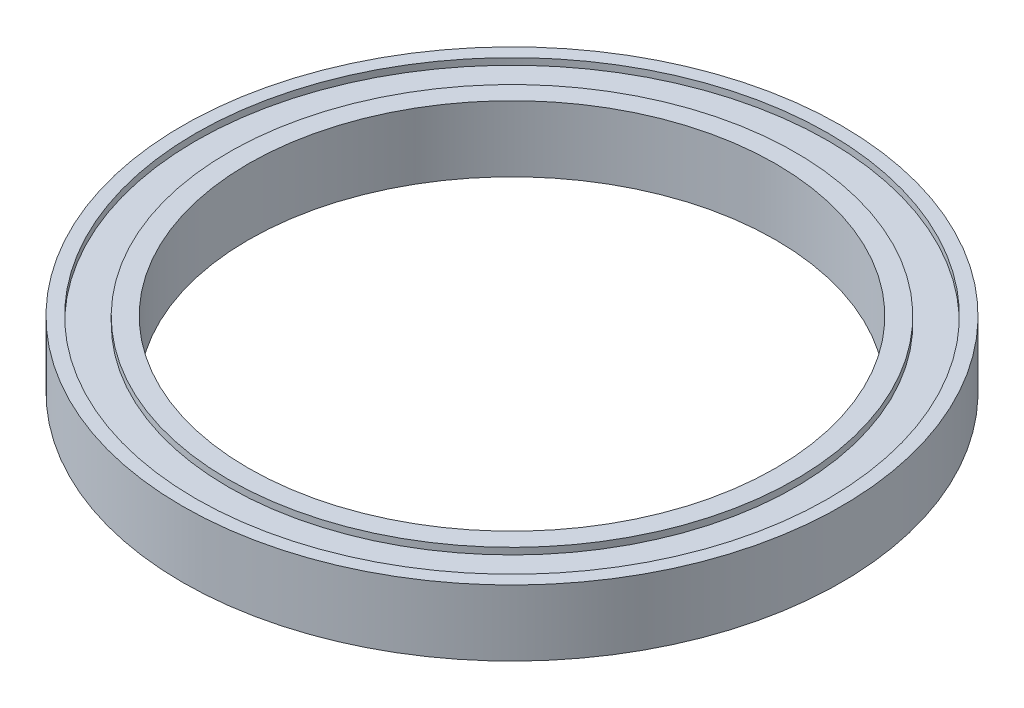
SolidWorks part; units mm, degrees
ref_plane "Front Plane" through (0, 0, 0) normal (0, 0, 1) x (1, 0, 0)
ref_plane "Top Plane" through (0, 0, 0) normal (0, 1, 0) x (1, 0, 0)
ref_plane "Right Plane" through (0, 0, 0) normal (1, 0, 0) x (0, 0, -1)
sketch "Sketch1" plane through (0, 0, 0) normal (0, 1, 0) x (1, 0, 0)
  circle A0 centre (0, 0) radius 40
  circle A1 centre (0, 0) radius 50
  dimension "D1" = 100
  dimension "D2" = 80
extrude "Boss-Extrude1" add sketch "Sketch1" along normal blind 10
sketch "Sketch2" plane through (0, 10, 0) normal (0, 1, 0) x (1, 0, 0)
  circle A0 centre (0, 0) radius 43
  circle A1 centre (0, 0) radius 48
  circle A2 centre (0, 0) radius 50 construction
  circle A3 centre (0, 0) radius 40 construction
  dimension "D1" = 2
  dimension "D2" = 3
extrude "Cut-Extrude1" cut sketch "Sketch2" against normal blind 1
sketch "Sketch3" plane through (0, 0, 0) normal (0, -1, 0) x (1, 0, 0)
  circle A0 centre (0, 0) radius 43
  circle A1 centre (0, 0) radius 48
  circle A2 centre (0, 0) radius 50 construction
  circle A3 centre (0, 0) radius 40 construction
  dimension "D1" = 2
  dimension "D2" = 3
extrude "Cut-Extrude2" cut sketch "Sketch3" against normal blind 1
